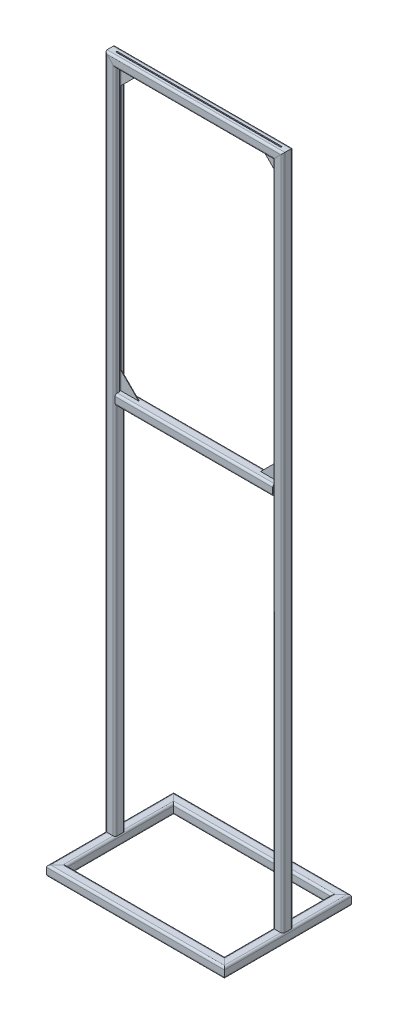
SolidWorks part; units mm, degrees
ref_plane "Front Plane" through (0, 0, 0) normal (0, 0, 1) x (1, 0, 0)
ref_plane "Top Plane" through (0, 0, 0) normal (0, 1, 0) x (1, 0, 0)
ref_plane "Right Plane" through (0, 0, 0) normal (1, 0, 0) x (0, 0, -1)
sketch "Base" plane through (0, 0, 0) normal (0, 1, 0) x (1, 0, 0)
  line L1 (-175, -125) -> (175, -125)
  line L2 (-175, -125) -> (-175, 125)
  line L3 (-175, 125) -> (175, 125)
  line L4 (175, -125) -> (175, 125)
  line L5 (-175, -125) -> (175, 125) construction
  line L6 (-175, 125) -> (175, -125) construction
  point P0 (0, 0)
  dimension "D1" = 250
  dimension "D2" = 350
sketch "Stand" plane through (0, 0, 0) normal (0, 0, 1) x (1, 0, 0)
  line L0 (-175, 0) -> (-175, 1350)
  line L1 (-175, 1350) -> (175, 1350)
  line L2 (175, 1350) -> (175, 0)
  line L3 (-175, 775) -> (175, 775)
  dimension "D1" = 1350
  dimension "D2" = 575
other "Tube (square) 20 X 20 X 2.0(1)"
ref_plane "Plane1" through (-175, 10, 115) normal (1, 0, 0) x (0, 0, -1)
sketch "Sketch1" plane through (-175, 10, 115) normal (1, 0, 0) x (0, 0, -1)
  line L0 (-6, -8) -> (6, -8)
  line L1 (-8, -6) -> (-8, 6)
  line L2 (6, 8) -> (-6, 8)
  line L3 (8, 6) -> (8, -6)
  line L4 (-6, -10) -> (6, -10)
  line L5 (-10, -6) -> (-10, 6)
  line L6 (6, 10) -> (-6, 10)
  line L7 (10, 6) -> (10, -6)
  line L8 (-10, 0) -> (-8, 0) construction
  line L9 (-8, 0) -> (8, 0) construction
  line L10 (8, 0) -> (10, 0) construction
  line L12 (0, 10) -> (0, 8) construction
  line L13 (0, 8) -> (0, -8) construction
  line L14 (0, -8) -> (0, -10) construction
  arc A0 (10, 6) -> (6, 10) centre (6, 6) ccw
  arc A1 (6, -10) -> (10, -6) centre (6, -6) ccw
  arc A2 (-10, -6) -> (-6, -10) centre (-6, -6) ccw
  arc A3 (-6, 10) -> (-10, 6) centre (-6, 6) ccw
  arc A4 (-6, 8) -> (-8, 6) centre (-6, 6) ccw
  arc A5 (8, 6) -> (6, 8) centre (6, 6) ccw
  arc A6 (6, -8) -> (8, -6) centre (6, -6) ccw
  arc A7 (-8, -6) -> (-6, -8) centre (-6, -6) ccw
  point P2 (-10, 10)
  point P33 (-10, -10)
  point P34 (10, -10)
  point P36 (10, 10)
  point P37 (0, 0)
  dimension "D1" = 4
  dimension "Thickness" = 2
  dimension "V_leg" = 20
  dimension "H_leg" = 20
sketch "Sketch2" plane through (0, 1350, 0) normal (0, 1, 0) x (1, 0, 0)
  line L0 (-162.5, 0) -> (162.5, 0)
  point P3 (0, 0)
  dimension "D1" = 325
extrude "Cut-Extrude-Thin1" cut sketch "Sketch2" against normal up to surface and the other way through all thin
other "Gusset1" parameters "D1"=1, "D2"=1, "D3"=0, "D4"=0, "D10"=5, "D11"=35, "D12"=35, "D13"=15, "D14"=45, "D15"=15
sketch "Sketch3" plane through (-155, 775, -1.25) normal (0, 0, -1) x (-1, 0, 0)
  line L0 (0, 0) -> (0, 35)
  line L1 (0, 0) -> (-35, 0)
  line L2 (0, 35) -> (-35, 0)
other "Gusset2" parameters "D1"=1, "D2"=1, "D3"=0, "D4"=0, "D10"=5, "D11"=35, "D12"=35, "D13"=15, "D14"=45, "D15"=15
sketch "Sketch4" plane through (-155, 1330, -1.25) normal (0, 0, -1) x (-1, 0, 0)
  line L0 (0, 0) -> (0, -35)
  line L1 (0, 0) -> (-35, 0)
  line L2 (0, -35) -> (-35, 0)
mirror "Mirror1" about plane through (0, 0, 0) normal (1, 0, 0)
